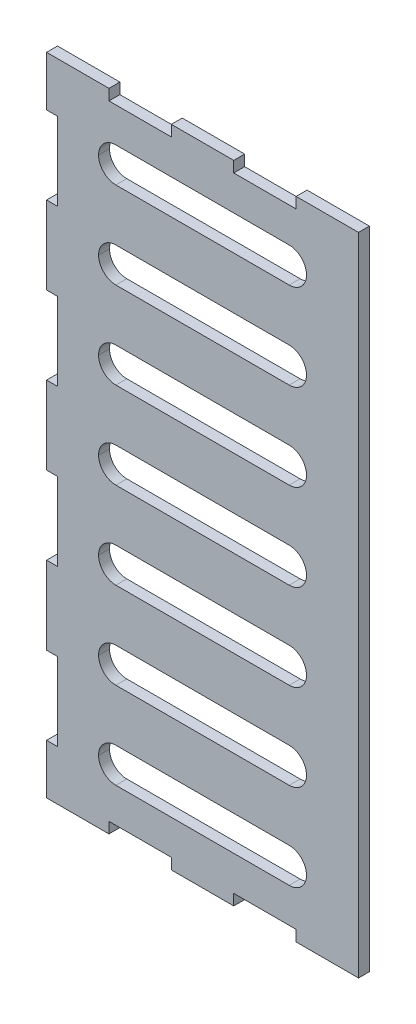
SolidWorks part; units mm, degrees
ref_plane "Front Plane" through (0, 0, 0) normal (0, 0, 1) x (1, 0, 0)
ref_plane "Top Plane" through (0, 0, 0) normal (0, 1, 0) x (1, 0, 0)
ref_plane "Right Plane" through (0, 0, 0) normal (1, 0, 0) x (0, 0, -1)
sketch "Sketch1" plane through (0, 0, 0) normal (0, 0, 1) x (1, 0, 0)
  line L0 (-311.4214, 497.0744) -> (-311.4214, 513.0744)
  line L1 (-494.3014, 497.0744) -> (-402.8614, 497.0744)
  line L2 (-585.7414, -433.3256) -> (-585.7414, -360.1736)
  line L3 (-494.3014, -417.3256) -> (-402.8614, -417.3256)
  line L4 (-128.5414, 513.0744) -> (-128.5414, -433.3256)
  line L7 (-830.2293, 39.8744) -> (-373.0293, 39.8744) construction
  line L8 (-569.7414, 211.3237) -> (-569.7414, 97.0237)
  line L9 (-585.7414, 513.0744) -> (-494.3014, 513.0744)
  line L10 (-494.3014, 497.0744) -> (-494.3014, 513.0744)
  line L11 (-402.8614, 513.0744) -> (-311.4214, 513.0744)
  line L12 (-402.8614, 497.0744) -> (-402.8614, 513.0744)
  line L13 (-585.7414, 439.9224) -> (-569.7414, 439.9224)
  line L14 (-219.9814, 513.0744) -> (-128.5414, 513.0744)
  line L15 (-219.9814, 497.0744) -> (-219.9814, 513.0744)
  line L16 (-311.4214, 497.0744) -> (-219.9814, 497.0744)
  line L17 (-219.9814, -433.3256) -> (-128.5414, -433.3256)
  line L18 (-219.9814, -417.3256) -> (-219.9814, -433.3256)
  line L19 (-311.4214, -417.3256) -> (-219.9814, -417.3256)
  line L20 (-311.4214, -417.3256) -> (-311.4214, -433.3256)
  line L21 (-402.8614, -433.3256) -> (-311.4214, -433.3256)
  line L22 (-402.8614, -417.3256) -> (-402.8614, -433.3256)
  line L23 (-585.7414, 325.6224) -> (-585.7414, 211.3237)
  line L24 (-494.3014, -417.3256) -> (-494.3014, -433.3256)
  line L25 (-585.7414, -433.3256) -> (-494.3014, -433.3256)
  line L26 (-585.7414, 325.6224) -> (-569.7414, 325.6224)
  line L27 (-569.7414, 439.9224) -> (-569.7414, 325.6224)
  line L28 (-585.7414, 211.3237) -> (-569.7414, 211.3237)
  line L29 (-128.5414, 497.0744) -> (-128.5414, 513.0744)
  line L30 (-585.7414, 97.0237) -> (-569.7414, 97.0237)
  line L31 (-569.7414, -17.275) -> (-569.7414, -131.575)
  line L32 (-585.7414, -17.275) -> (-569.7414, -17.275)
  line L33 (-585.7414, -131.575) -> (-569.7414, -131.575)
  line L34 (-569.7414, -245.8736) -> (-569.7414, -360.1736)
  line L35 (-585.7414, -245.8736) -> (-569.7414, -245.8736)
  line L36 (-585.7414, -360.1736) -> (-569.7414, -360.1736)
  line L37 (-585.7414, 439.9224) -> (-585.7414, 513.0744)
  line L38 (-585.7414, -17.275) -> (-585.7414, 97.0237)
  line L39 (-585.7414, -245.8736) -> (-585.7414, -131.575)
  line L40 (-204.7414, -188.7256) -> (-509.5414, -188.7256)
  line L41 (-204.7414, -315.7256) -> (-509.5414, -315.7256)
  line L42 (-204.7414, -315.7256) -> (-204.7414, -366.5256)
  line L43 (-204.7414, -366.5256) -> (-509.5414, -366.5256)
  line L44 (-509.5414, -315.7256) -> (-509.5414, -366.5256)
  line L45 (-204.7414, -188.7256) -> (-204.7414, -239.5256)
  line L46 (-204.7414, -239.5256) -> (-509.5414, -239.5256)
  line L47 (-509.5414, -188.7256) -> (-509.5414, -239.5256)
  line L48 (-204.7414, -61.7256) -> (-509.5414, -61.7256)
  line L49 (-204.7414, -61.7256) -> (-204.7414, -112.5256)
  line L50 (-204.7414, -112.5256) -> (-509.5414, -112.5256)
  line L51 (-509.5414, -61.7256) -> (-509.5414, -112.5256)
  line L52 (-204.7414, 65.2744) -> (-509.5414, 65.2744)
  line L53 (-204.7414, 65.2744) -> (-204.7414, 14.4744)
  line L54 (-204.7414, 14.4744) -> (-509.5414, 14.4744)
  line L55 (-509.5414, 65.2744) -> (-509.5414, 14.4744)
  line L56 (-204.7414, 192.2744) -> (-509.5414, 192.2744)
  line L57 (-204.7414, 192.2744) -> (-204.7414, 141.4744)
  line L58 (-204.7414, 141.4744) -> (-509.5414, 141.4744)
  line L59 (-509.5414, 192.2744) -> (-509.5414, 141.4744)
  line L60 (-204.7414, 319.2744) -> (-509.5414, 319.2744)
  line L61 (-204.7414, 319.2744) -> (-204.7414, 268.4744)
  line L62 (-204.7414, 268.4744) -> (-509.5414, 268.4744)
  line L63 (-509.5414, 319.2744) -> (-509.5414, 268.4744)
  line L64 (-204.7414, 446.2744) -> (-509.5414, 446.2744)
  line L65 (-204.7414, 446.2744) -> (-204.7414, 395.4744)
  line L66 (-204.7414, 395.4744) -> (-509.5414, 395.4744)
  line L67 (-509.5414, 446.2744) -> (-509.5414, 395.4744)
  point P0 (-351.4583, 51.045)
  point P49 (-357.1414, -366.5256)
extrude "Boss-Extrude1" add sketch "Sketch1" along normal blind 16
fillet "Fillet1" radius 25.4 28 edges at (-509.5414, -315.7256, 8) (-509.5414, -188.7256, 8) (-509.5414, -61.7256, 8) (-509.5414, 65.2744, 8) (-509.5414, 192.2744, 8) (-509.5414, 319.2744, 8) (-509.5414, 446.2744, 8) (-509.5414, 395.4744, 8) (-509.5414, 268.4744, 8) (-509.5414, 141.4744, 8) (-509.5414, 14.4744, 8) (-509.5414, -112.5256, 8) (-509.5414, -239.5256, 8) (-509.5414, -366.5256, 8) (-204.7414, 446.2744, 8) (-204.7414, 319.2744, 8) (-204.7414, 192.2744, 8) (-204.7414, 65.2744, 8) (-204.7414, -61.7256, 8) (-204.7414, -188.7256, 8) (-204.7414, -315.7256, 8) (-204.7414, 395.4744, 8) (-204.7414, 268.4744, 8) (-204.7414, 141.4744, 8) (-204.7414, 14.4744, 8) (-204.7414, -112.5256, 8) (-204.7414, -239.5256, 8) (-204.7414, -366.5256, 8)
equation "\"length\"= 36in"
equation "\"height\"= 18in"
equation "\"material thickness\"= 16mm"
equation "\"D1@Boss-Extrude1\"=\"material thickness\""
equation "\"D4@Sketch1\"=\"height\"/5"
equation "\"D6@Sketch1\"=\"material thickness\""
equation "\"D7@Sketch1\"=\"length\"/8"
equation "\"D15@Sketch1\"=\"length\""
equation "\"D16@Sketch1\"=\"material thickness\""
